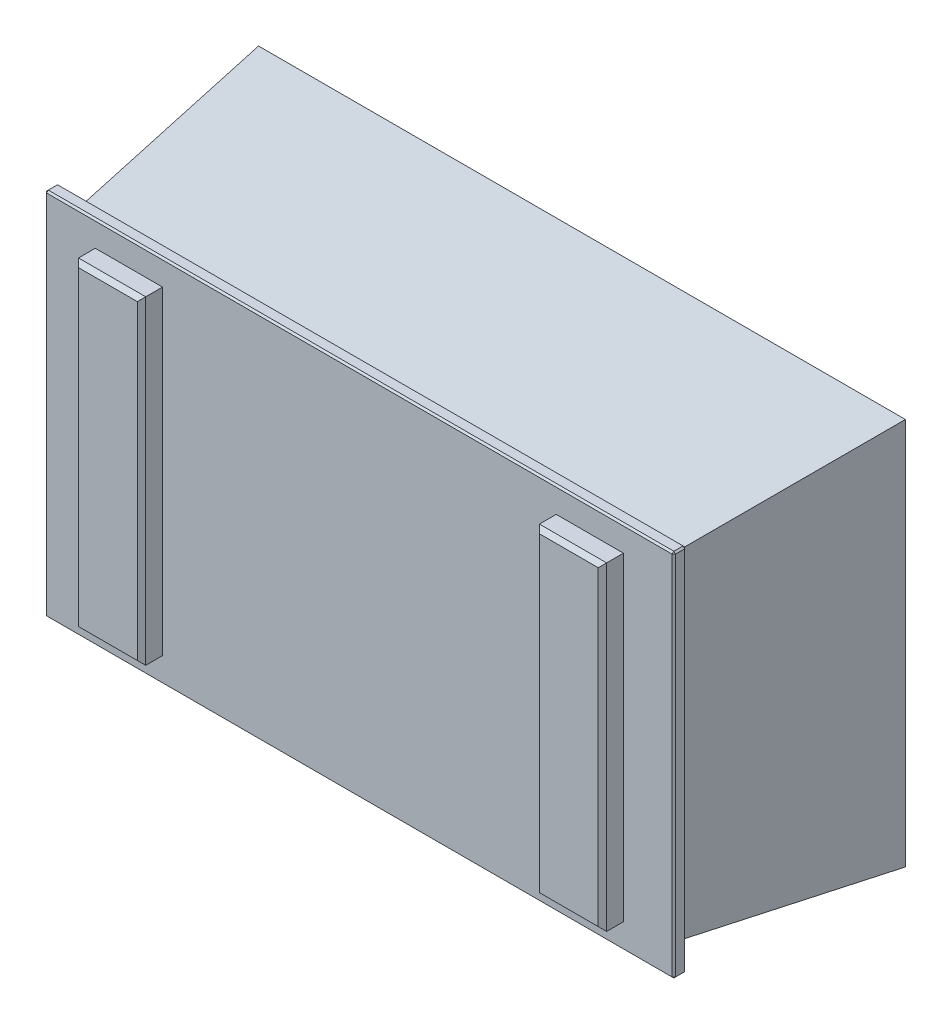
SolidWorks part; units mm, degrees
ref_plane "Plan de face" through (0, 0, 0) normal (0, 0, 1) x (1, 0, 0)
ref_plane "Plan de dessus" through (0, 0, 0) normal (0, 1, 0) x (1, 0, 0)
ref_plane "Plan de droite" through (0, 0, 0) normal (1, 0, 0) x (0, 0, -1)
sketch "Esquisse1" plane through (0, 0, -44.9002) normal (0, 0, 1) x (1, 0, 0)
  line L1 (-501.2176, 220) -> (247.5188, 220)
  line L2 (-501.2176, 220) -> (-501.2176, -220)
  line L3 (-501.2176, -220) -> (247.5188, -220)
  line L4 (247.5188, 220) -> (247.5188, -220)
  circle A1 centre (27.5188, 0) radius 12.5401 construction
  circle A2 centre (-281.2176, 0) radius 12.5401 construction
  dimension "D3" = 220
  dimension "D4" = 220
  dimension "D1" = 220
  dimension "D2" = 440
extrude "Boss.-Extru.1" add sketch "Esquisse1" along normal blind 15
sketch "Esquisse2" plane through (0, 0, -44.9002) normal (0, 0, -1) x (-1, 0, 0)
  line L4 (461.2176, -180) -> (461.2176, 180)
  line L5 (461.2176, 180) -> (-207.5188, 180)
  line L6 (-207.5188, 180) -> (-207.5188, -180)
  line L7 (-207.5188, -180) -> (461.2176, -180)
  line L8 (481.2176, -200) -> (481.2176, 200)
  line L9 (481.2176, 200) -> (-227.5188, 200)
  line L10 (-227.5188, 200) -> (-227.5188, -200)
  line L11 (-227.5188, -200) -> (481.2176, -200)
  line L12 (481.2176, -200) -> (481.2176, 200)
  line L13 (481.2176, 200) -> (-227.5188, 200)
  line L14 (-227.5188, 200) -> (-227.5188, -200)
  line L15 (-227.5188, -200) -> (481.2176, -200)
  dimension "D1" = 20
  dimension "D2" = 20
extrude "Boss.-Extru.2" add sketch "Esquisse2" along normal blind 250 draft 7
sketch "Esquisse3" plane through (0, 0, -44.9002) normal (0, 0, -1) x (-1, 0, 0)
  line L0 (461.2176, 180) -> (-207.5188, 180) construction
  line L1 (-207.5188, 180) -> (-207.5188, -180) construction
  line L2 (461.2176, -180) -> (461.2176, 180) construction
  line L3 (-207.5188, -180) -> (461.2176, -180) construction
  line L4 (461.2176, 180) -> (-207.5188, 180)
  line L5 (-207.5188, 180) -> (-207.5188, -180)
  line L6 (461.2176, -180) -> (461.2176, 180)
  line L7 (-207.5188, -180) -> (461.2176, -180)
extrude "Enlèv. mat.-Extru.1" cut sketch "Esquisse3" along normal up to surface (250 mm away) draft 7
sketch "Esquisse4" plane through (0, 0, -29.9002) normal (0, 0, 1) x (1, 0, 0)
  line L0 (247.5188, -220) -> (247.5188, 220) construction
  line L1 (187.5188, -190) -> (107.5188, -190)
  line L2 (187.5188, -190) -> (187.5188, 190)
  line L3 (187.5188, 190) -> (107.5188, 190)
  line L4 (107.5188, -190) -> (107.5188, 190)
  line L5 (-361.2176, -190) -> (-441.2176, -190)
  line L6 (-361.2176, -190) -> (-361.2176, 190)
  line L7 (-361.2176, 190) -> (-441.2176, 190)
  line L8 (-441.2176, -190) -> (-441.2176, 190)
  line L9 (-501.2176, 220) -> (-501.2176, -220) construction
  line L10 (-501.2176, -220) -> (247.5188, -220) construction
  line L11 (247.5188, 220) -> (-501.2176, 220) construction
  dimension "D1" = 80
  dimension "D2" = 80
  dimension "D3" = 60
  dimension "D4" = 60
  dimension "D5" = 30
  dimension "D6" = 30
extrude "Boss.-Extru.3" add sketch "Esquisse4" along normal blind 25
chamfer "Chanfrein1" distance 5 angle 45 8 edges at (-401.2176, -190, -4.9002) (-441.2176, 0, -4.9002) (-401.2176, 190, -4.9002) (-361.2176, 0, -4.9002) (147.5188, -190, -4.9002) (107.5188, 0, -4.9002) (147.5188, 190, -4.9002) (187.5188, 0, -4.9002)
chamfer "Chanfrein2" distance 2 angle 45 12 edges at (247.5188, 0, -29.9002) (247.5188, 0, -44.9002) (-501.2176, 0, -29.9002) (-501.2176, -220, -37.4002) (-126.8494, -220, -29.9002) (247.5188, -220, -37.4002) (-126.8494, -220, -44.9002) (-501.2176, 0, -44.9002) (247.5188, 220, -37.4002) (-126.8494, 220, -29.9002) (-501.2176, 220, -37.4002) (-126.8494, 220, -44.9002)
